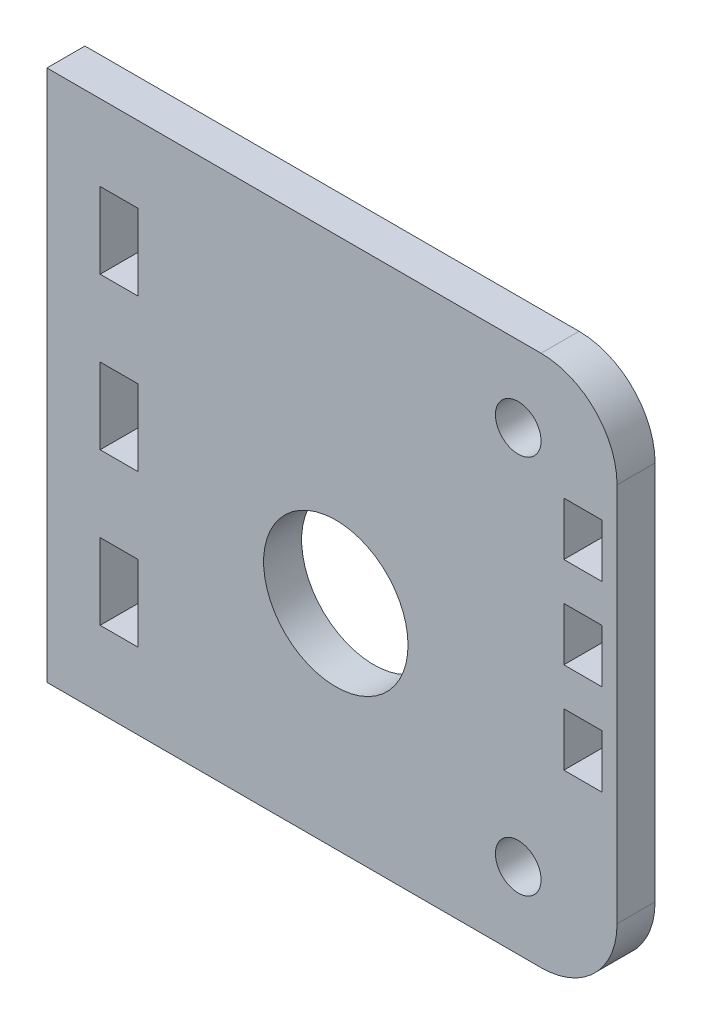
SolidWorks part; units mm, degrees
ref_plane "Plan de face" through (0, 0, 0) normal (0, 0, 1) x (1, 0, 0)
ref_plane "Plan de dessus" through (0, 0, 0) normal (0, 1, 0) x (1, 0, 0)
ref_plane "Plan de droite" through (0, 0, 0) normal (1, 0, 0) x (0, 0, -1)
sketch "Esquisse1" plane through (0, 0, 0) normal (0, 0, 1) x (1, 0, 0)
  line L1 (0, -35) -> (-30, -35)
  line L2 (0, -35) -> (0, 35)
  line L3 (0, 35) -> (-30, 35)
  line L4 (-30, -35) -> (-30, 35)
  dimension "D1" = 30
  dimension "D2" = 70
  dimension "D3" = 35
extrude "Boss.-Extru.1" add sketch "Esquisse1" along normal blind 5
sketch "Esquisse3" plane through (0, 0, 5) normal (0, 0, 1) x (1, 0, 0)
  line L0 (0, -35) -> (0, 35) construction
  line L1 (0, -35) -> (-5, -35)
  line L2 (0, -35) -> (0, -25)
  line L3 (0, -25) -> (-5, -25)
  line L4 (-5, -35) -> (-5, -25)
  line L5 (0, -5) -> (-5, -5)
  line L6 (0, -15) -> (0, -5)
  line L7 (0, -15) -> (-5, -15)
  line L8 (-5, -15) -> (-5, -5)
  line L9 (0, 15) -> (-5, 15)
  line L10 (0, 5) -> (0, 15)
  line L11 (0, 5) -> (-5, 5)
  line L12 (-5, 5) -> (-5, 15)
  line L13 (0, 35) -> (-5, 35)
  line L14 (0, 25) -> (0, 35)
  line L15 (0, 25) -> (-5, 25)
  line L16 (-5, 25) -> (-5, 35)
  dimension "D1" = 5
  dimension "D2" = 10
  dimension "D3" = 25
  dimension "D4" = 4
extrude "Enlèv. mat.-Extru.2" cut sketch "Esquisse3" against normal blind 10
sketch "Esquisse4" plane through (0, 0, 0) normal (1, 0, 0) x (0, 0, -1)
  line L1 (-5, 35) -> (0, 35)
  line L2 (-5, 35) -> (-5, -35)
  line L3 (-5, -35) -> (0, -35)
  line L4 (0, 35) -> (0, -35)
extrude "Boss.-Extru.2" add sketch "Esquisse4" along normal blind 25
sketch "Esquisse5" plane through (0, 0, 5) normal (0, 0, 1) x (1, 0, 0)
  line L0 (0, 35) -> (0, 25) construction
  line L1 (25, 35) -> (0, 35) construction
  line L2 (12, 25) -> (12, -25) construction
  line L3 (25, -35) -> (0, -35) construction
  line L4 (0, -25) -> (0, -35) construction
  circle A0 centre (12, 25) radius 3
  circle A1 centre (12, -25) radius 3
  dimension "D4" = 6
  dimension "D5" = 6
  dimension "D6" = 12
  dimension "D1" = 12
  dimension "D2" = 10
  dimension "D3" = 10
extrude "Enlèv. mat.-Extru.3" cut sketch "Esquisse5" against normal blind 5
fillet "Congé1" radius 10 2 edges at (25, 35, 2.5) (25, -35, 2.5)
sketch "Esquisse6" plane through (0, 0, 5) normal (0, 0, 1) x (1, 0, 0)
  line L1 (-30, -35) -> (0, -35)
  line L2 (-30, -35) -> (-30, 35)
  line L3 (-30, 35) -> (0, 35)
  line L4 (0, -35) -> (0, 35)
extrude "Enlèv. mat.-Extru.4" cut sketch "Esquisse6" against normal blind 10
sketch "Esquisse7" plane through (0, 0, 0) normal (-1, 0, 0) x (0, 0, 1)
  line L4 (0, -35) -> (5, -35)
  line L5 (5, -35) -> (5, 35)
  line L6 (5, 35) -> (0, 35)
  line L7 (0, 35) -> (0, -35)
  line L8 (0, -35) -> (5, -35)
  line L9 (5, -35) -> (5, 35)
  line L10 (5, 35) -> (0, 35)
  line L11 (0, 35) -> (0, -35)
  dimension "D1" = 0
extrude "Boss.-Extru.3" add sketch "Esquisse7" along normal blind 50
sketch "Esquisse8" plane through (0, 0, 5) normal (0, 0, 1) x (1, 0, 0)
  circle A0 centre (-12, -7) radius 4.6
  dimension "D2" = 7
  dimension "D3" = 9.2
  dimension "D1" = 12
extrude "Enlèv. mat.-Extru.5" cut sketch "Esquisse8" against normal blind 50
sketch "Esquisse9" plane through (0, 0, 5) normal (0, 0, 1) x (1, 0, 0)
  line L0 (25, 25) -> (25, -25) construction
  line L1 (18, 20) -> (23, 20)
  line L2 (18, 20) -> (18, 13)
  line L3 (18, 13) -> (23, 13)
  line L4 (23, 20) -> (23, 13)
  line L5 (15, 35) -> (-50, 35) construction
  line L6 (18, 8) -> (23, 8)
  line L7 (18, 8) -> (18, 1)
  line L8 (18, 1) -> (23, 1)
  line L9 (23, 8) -> (23, 1)
  line L10 (18, -4) -> (23, -4)
  line L11 (18, -4) -> (18, -11)
  line L12 (18, -11) -> (23, -11)
  line L13 (23, -4) -> (23, -11)
  dimension "D1" = 5
  dimension "D2" = 7
  dimension "D3" = 2
  dimension "D4" = 15
  dimension "D5" = 3
extrude "Enlèv. mat.-Extru.6" cut sketch "Esquisse9" against normal blind 10
sketch "Esquisse10" plane through (0, 0, 5) normal (0, 0, 1) x (1, 0, 0)
  line L0 (15, 35) -> (-50, 35) construction
  line L1 (-43, 25) -> (-38, 25)
  line L2 (-43, 25) -> (-43, 15)
  line L3 (-43, 15) -> (-38, 15)
  line L4 (-38, 25) -> (-38, 15)
  line L5 (-50, -35) -> (-50, 35) construction
  line L6 (-43, 5) -> (-38, 5)
  line L7 (-43, 5) -> (-43, -5)
  line L8 (-43, -5) -> (-38, -5)
  line L9 (-38, 5) -> (-38, -5)
  line L10 (-43, -15) -> (-38, -15)
  line L11 (-43, -15) -> (-43, -25)
  line L12 (-43, -25) -> (-38, -25)
  line L13 (-38, -15) -> (-38, -25)
  dimension "D1" = 5
  dimension "D2" = 10
  dimension "D3" = 10
  dimension "D4" = 7
  dimension "D5" = 3
extrude "Enlèv. mat.-Extru.7" cut sketch "Esquisse10" against normal blind 10
sketch "Esquisse11" plane through (0, 0, 5) normal (0, 0, 1) x (1, 0, 0)
  circle A0 centre (-12, -7) radius 9.5
  dimension "D1" = 19
extrude "Enlèv. mat.-Extru.8" cut sketch "Esquisse11" against normal blind 30
